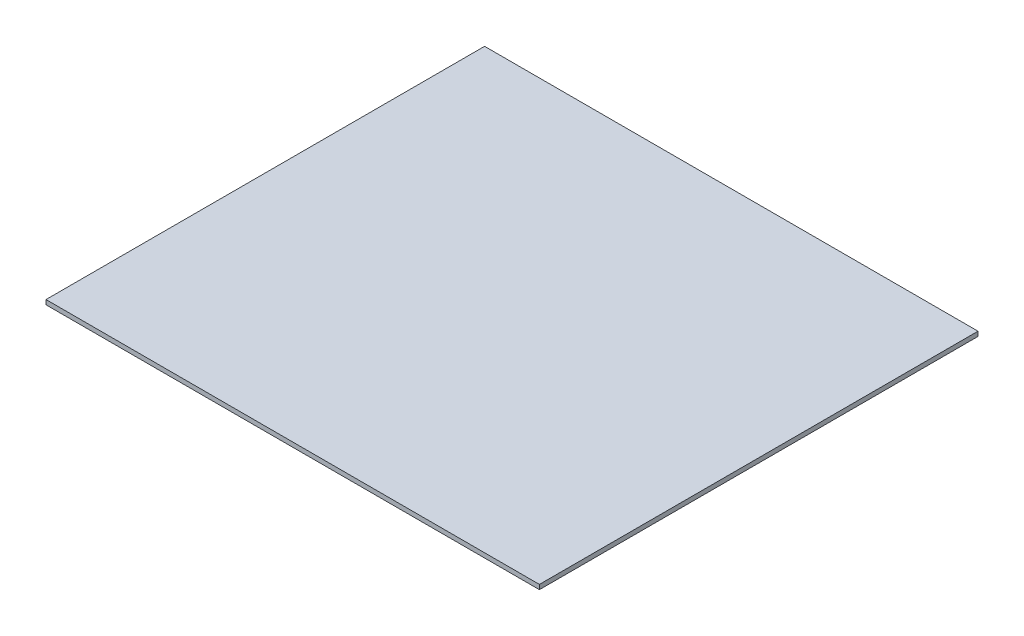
SolidWorks part; units mm, degrees
ref_plane "Front Plane" through (0, 0, 0) normal (0, 0, 1) x (1, 0, 0)
ref_plane "Top Plane" through (0, 0, 0) normal (0, 1, 0) x (1, 0, 0)
ref_plane "Right Plane" through (0, 0, 0) normal (1, 0, 0) x (0, 0, -1)
sketch "Sketch1" plane through (0, 0, 0) normal (0, 1, 0) x (1, 0, 0)
  line L1 (0, 0) -> (1371.6, 0)
  line L2 (0, 0) -> (0, 1219.2)
  line L3 (0, 1219.2) -> (1371.6, 1219.2)
  line L4 (1371.6, 0) -> (1371.6, 1219.2)
  dimension "D1" = 1371.6
  dimension "D2" = 1219.2
extrude "Extrude1" add sketch "Sketch1" against normal blind 12.7
